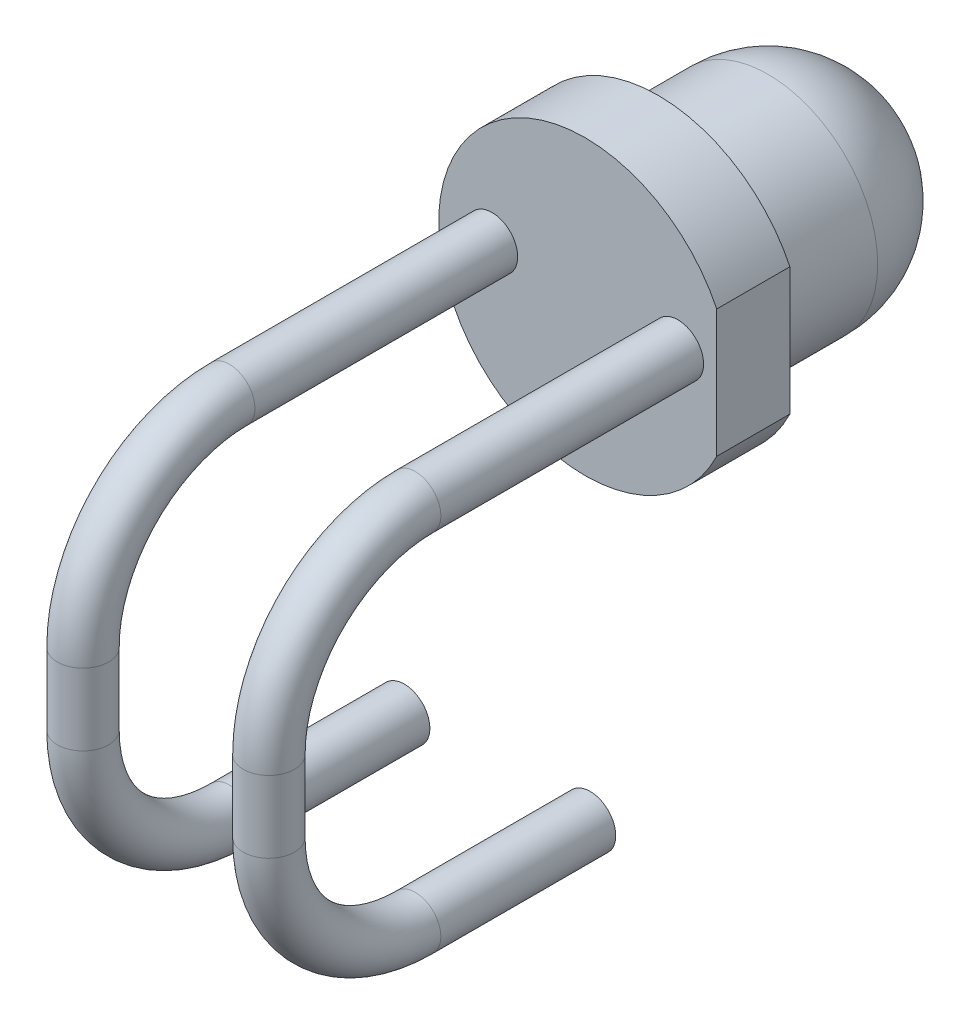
SolidWorks part; units mm, degrees
ref_plane "Face" through (0, 0, 0) normal (0, 0, 1) x (1, 0, 0)
ref_plane "Dessus" through (0, 0, 0) normal (0, 1, 0) x (1, 0, 0)
ref_plane "Droite" through (0, 0, 0) normal (1, 0, 0) x (0, 0, -1)
sketch "Esquisse1" plane through (0, 0, 0) normal (0, 0, 1) x (1, 0, 0)
  circle A0 centre (0, 0) radius 1.5
  dimension "D1" = 3
extrude "Base-Extrusion" add sketch "Esquisse1" along normal blind 4
sketch "Esquisse2" plane through (0, 0, 4) normal (0, 0, 1) x (1, 0, 0)
  line L2 (1.8, 0.8718) -> (1.8, -0.8718)
  arc A0 (1.8, 0.8718) -> (1.8, -0.8718) centre (0, 0) ccw
extrude "Boss.-Extru.1" add sketch "Esquisse2" against normal blind 1
fillet "Congé1" radius 1.5 1 edges at (1.5, 0, 0)
ref_plane "Plan1" through (1.27, 0, 0) normal (1, 0, 0) x (0, 0, -1)
sketch "Esquisse9" plane through (1.27, 0, 0) normal (1, 0, 0) x (0, 0, -1)
  line L0 (-4, 0.1287) -> (-7.59, 0.1287)
  line L1 (-9.59, -1.8713) -> (-9.59, -2.8513)
  line L2 (-7.59, -4.8513) -> (-5.2, -4.8513)
  arc A0 (-7.59, 0.1287) -> (-9.59, -1.8713) centre (-7.59, -1.8713) ccw
  arc A1 (-9.59, -2.8513) -> (-7.59, -4.8513) centre (-7.59, -2.8513) ccw
  point P12 (-9.59, 0.1287)
  point P15 (-9.59, -4.8513)
  dimension "D1" = 2
sketch "Esquisse10" plane through (0, 0, 4) normal (0, 0, 1) x (1, 0, 0)
  circle A0 centre (1.27, 0.1287) radius 0.35
sweep "Balayage1" add profiles "Esquisse10" path "Esquisse9"
sketch "Esquisse11" plane through (0, 0, 4) normal (0, 0, 1) x (1, 0, 0)
  line L0 (-2.8136, 0) -> (3.6896, 0)
pattern_linear "Répétition linéaire1" count 2 spacing 2.54 along (-1, 0, 0) of "Balayage1"
